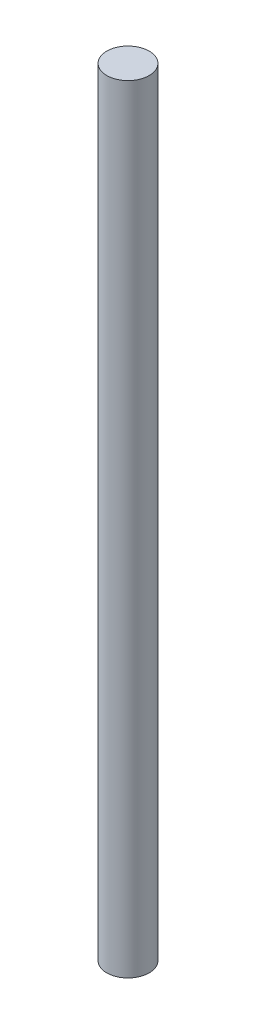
SolidWorks part; units mm, degrees
ref_plane "Plan de face" through (0, 0, 0) normal (0, 0, 1) x (1, 0, 0)
ref_plane "Plan de dessus" through (0, 0, 0) normal (0, 1, 0) x (1, 0, 0)
ref_plane "Plan de droite" through (0, 0, 0) normal (1, 0, 0) x (0, 0, -1)
sketch "Esquisse1" plane through (0, 0, 0) normal (0, 1, 0) x (1, 0, 0)
  circle A0 centre (0, 0) radius 3
  dimension "D1" = 6
extrude "Extrusion1" add sketch "Esquisse1" along normal blind 110
